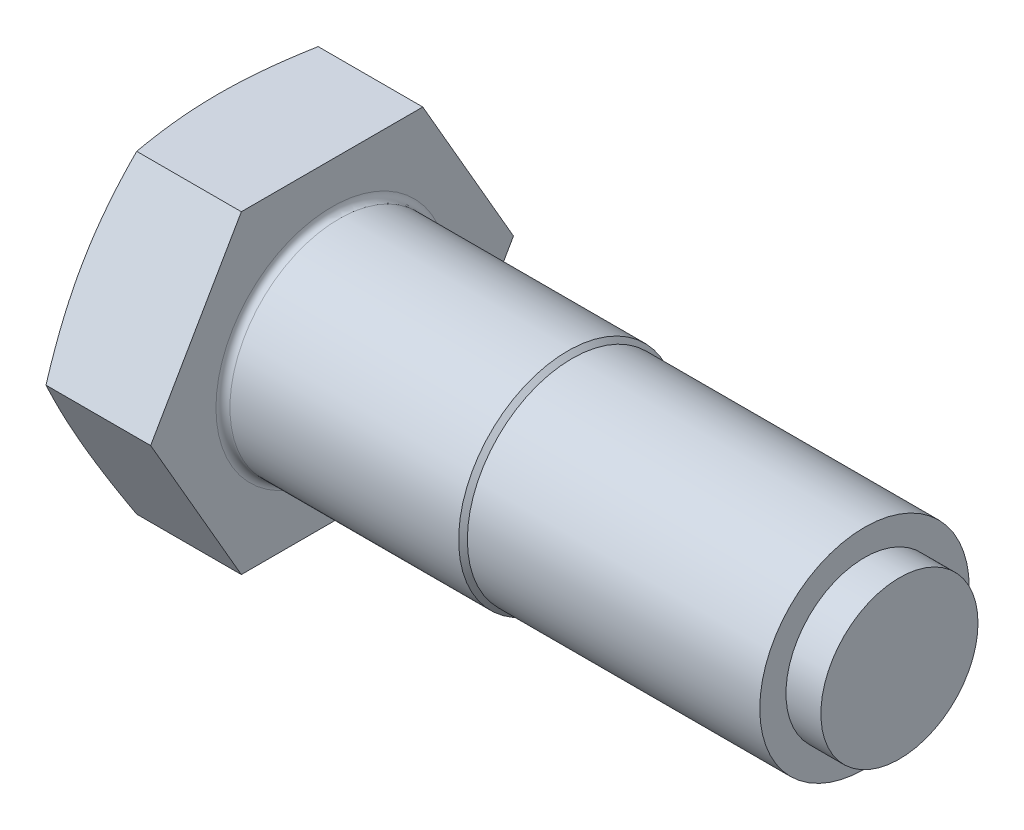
SolidWorks part; units mm, degrees
ref_plane "Front" through (0, 0, 0) normal (0, 0, 1) x (1, 0, 0)
ref_plane "Top" through (0, 0, 0) normal (0, 1, 0) x (1, 0, 0)
ref_plane "Right" through (0, 0, 0) normal (1, 0, 0) x (0, 0, -1)
sketch "Sketch1" plane through (0, 0, 0) normal (1, 0, 0) x (0, 0, -1)
  line L1 (20.7846, 0) -> (10.3923, 18)
  line L2 (10.3923, 18) -> (-10.3923, 18)
  line L3 (-10.3923, 18) -> (-20.7846, 0)
  line L4 (-20.7846, 0) -> (-10.3923, -18)
  line L5 (-10.3923, -18) -> (10.3923, -18)
  line L6 (10.3923, -18) -> (20.7846, 0)
  circle A0 centre (0, 0) radius 18 construction
  dimension "s" = 36
extrude "BaseHead" add sketch "Sketch1" along normal blind 13
sketch "Sketch2" plane through (13, 0, 0) normal (1, 0, 0) x (0, 0, -1)
  circle A0 centre (0, 0) radius 12.5
  dimension "ds" = 25
extrude "Basebody1" add sketch "Sketch2" along normal blind 27
sketch "Sketch4" plane through (40, 0, 0) normal (1, 0, 0) x (0, 0, -1)
  circle A0 centre (0, 0) radius 12
  dimension "d" = 24
extrude "Basebody2" add sketch "Sketch4" along normal offset from surface (38 mm away) 65
sketch "Sketch5" plane through (78, 0, 0) normal (1, 0, 0) x (0, 0, -1)
  circle A0 centre (0, 0) radius 9
  dimension "dp" = 18
extrude "Cut-Extrude1" cut sketch "Sketch5" against normal blind 4 flip side to cut
sketch "Sketch6" plane through (0, 0, 0) normal (0, 1, 0) x (1, 0, 0)
  line L0 (0, 20.7846) -> (1.0135, 20.7846)
  line L1 (1.0135, 20.7846) -> (0, 18)
  line L3 (0, 18) -> (0, 20.7846)
  line L4 (-1.5773, 0) -> (3.1205, 0) construction
  line L6 (13, 20.7846) -> (0, 20.7846) construction
  dimension "D1" = 20
  dimension "D2" = 36
revolve "HeadChamfer" cut sketch "Sketch6" angle 360 about L4
fillet "HeadFillet" radius 0.8 1 edges at (13, 0, -12.5)
chamfer "Chamfer1" distance 0.5 angle 45 1 edges at (40, 0, -12)
equation "\"D1@Chamfer1\" =  ( \"ds@Sketch2\" - \"d@Sketch4\" )  / 2"
equation "\"D2@Sketch6\" = \"s@Sketch1\""
